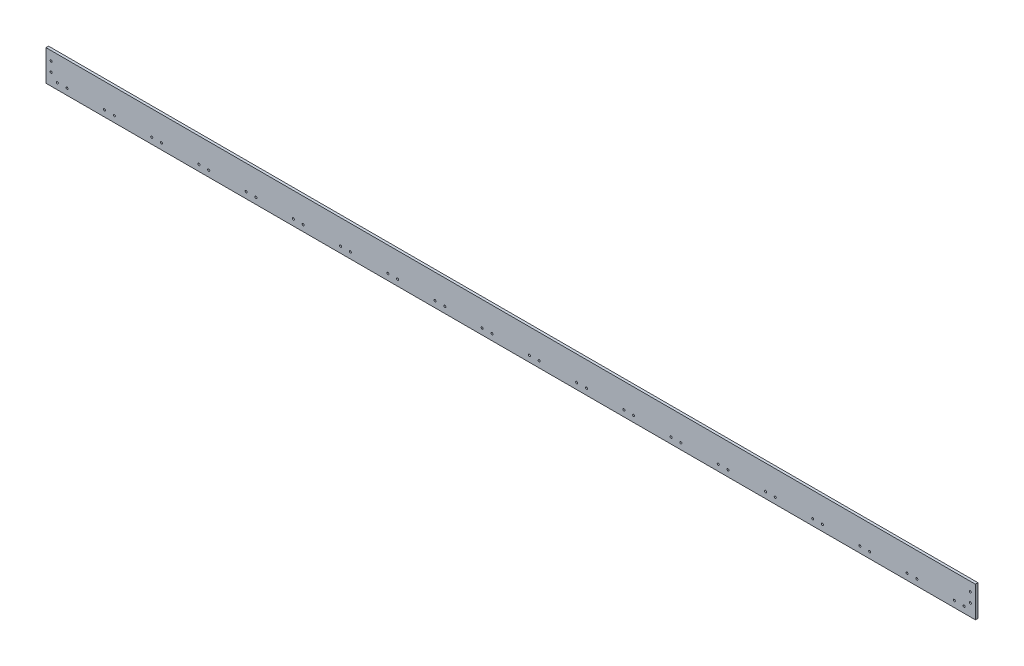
SolidWorks part; units mm, degrees
ref_plane "Front Plane" through (0, 0, 0) normal (0, 0, 1) x (1, 0, 0)
ref_plane "Top Plane" through (0, 0, 0) normal (0, 1, 0) x (1, 0, 0)
ref_plane "Right Plane" through (0, 0, 0) normal (1, 0, 0) x (0, 0, -1)
sketch "Sketch1" plane through (0, 0, 0) normal (0, 0, 1) x (1, 0, 0)
  line L1 (0, 0) -> (2292.35, 0)
  line L2 (0, 0) -> (0, 76.2)
  line L3 (0, 76.2) -> (2292.35, 76.2)
  line L4 (2292.35, 0) -> (2292.35, 76.2)
extrude "Boss-Extrude1" add sketch "Sketch1" along normal blind 6.35
sketch "Sketch2" plane through (0, 0, 6.35) normal (0, 0, 1) x (1, 0, 0)
  line L0 (27.94, 0) -> (27.94, 12.7) construction
  line L2 (0, 15.24) -> (25.4, 15.24) construction
  line L3 (0, 76.2) -> (0, 0) construction
  line L4 (0, 0) -> (2292.35, 0) construction
  line L5 (30.48, 15.24) -> (49.53, 15.24) construction
  circle A0 centre (27.94, 15.24) radius 2.54
  circle A1 centre (52.07, 15.24) radius 2.54
  point P13 (1219.2, 76.2)
extrude "Cut-Extrude1" cut sketch "Sketch2" against normal up to surface (6.35 mm away) contours A1 | A0
sketch "Sketch3" plane through (0, 0, 6.35) normal (0, 0, 1) x (1, 0, 0)
  line L0 (0, 76.2) -> (0, 0) construction
  line L1 (2292.35, 76.2) -> (0, 76.2) construction
  line L2 (12.7, 41.91) -> (0, 41.91) construction
  line L3 (12.7, 51.435) -> (12.7, 32.385) construction
  line L4 (0, 41.91) -> (0, 38.1) construction
  line L5 (1146.175, 76.2) -> (1146.175, 0) construction
  line L6 (0, 0) -> (2292.35, 0) construction
  circle A0 centre (12.7, 29.845) radius 2.54
  circle A1 centre (12.7, 53.975) radius 2.54
  circle A2 centre (2279.65, 29.845) radius 2.54
  circle A3 centre (2279.65, 53.975) radius 2.54
  point P13 (0, 38.1)
  point P15 (1146.175, 76.2)
  point P17 (12.7, 41.91)
  point P27 (12.7, 41.91)
extrude "Cut-Extrude2" cut sketch "Sketch3" against normal up to surface (6.35 mm away)
pattern_linear "LPattern2" count 20 spacing 116.4389 along (1, 0, 0) of "Cut-Extrude1"
equation "\"vertical-component-width\"= \"railing-hypotenuse\" - \"railing-hypotenuse-vertical-component-width-difference\""
equation "\"vertical-component-height\"= 3in"
equation "\"material-thickness\"= .25in"
equation "\"D1@Sketch1\"=\"vertical-component-height\""
equation "\"D2@Sketch1\"=\"vertical-component-width\""
equation "\"D1@Boss-Extrude1\"=\"material-thickness\""
equation "\"mounting-hole-diameter\"= .2"
equation "\"mounting-hole-pair-left-to-mount-edge-left\"= 1in"
equation "\"mounting-hole-bottom-to-mount-edge-bottom\"= .5in"
equation "\"mounting-hole-pair-distance-between-holes\"= .75in"
equation "\"distance-between-mounting-hole-pairs\"= ( \"vertical-component-width\" - 2 * \"mounting-hole-pair-left-to-mount-edge-left\" - \"num-mounting-hole-pairs\" * ( 2 * \"mounting-hole-diameter\" + \"mounting-hole-pa"
equation "\"num-mounting-hole-pairs\"= 20"
equation "\"D3@Sketch2\"=\"mounting-hole-pair-distance-between-holes\""
equation "\"D5@Sketch2\"=\"mounting-hole-bottom-to-mount-edge-bottom\""
equation "\"D4@Sketch2\"=\"mounting-hole-pair-left-to-mount-edge-left\""
equation "\"D3@LPattern2\"=\"mounting-hole-pair-left-to-next-mounting-hole-pair-left\""
equation "\"D2@Sketch2\"=\"mounting-hole-diameter\""
equation "\"D1@Sketch2\"=\"mounting-hole-diameter\""
equation "\"mounting-hole-pair-left-to-next-mounting-hole-pair-left\"= \"distance-between-mounting-hole-pairs\" + 2 * \"mounting-hole-diameter\" + \"mounting-hole-pair-distance-between-holes\""
equation "\"edge-mounting-hole-pair-inset\"=0.5"
equation "\"D4@Sketch3\"=\"edge-mounting-hole-pair-inset\""
equation "\"edge-mounting-hole-pair-offset-from-mount-vertical-center\"= 0.15"
equation "\"D5@Sketch3\"=\"edge-mounting-hole-pair-offset-from-mount-vertical-center\""
equation "\"D3@Sketch3\"=\"mounting-hole-pair-distance-between-holes\""
equation "\"railing-hypotenuse\"= 92in"
equation "\"railing-hypotenuse-vertical-component-width-difference\"= 1.75in"
equation "\"D1@LPattern2\"=\"num-mounting-hole-pairs\""
